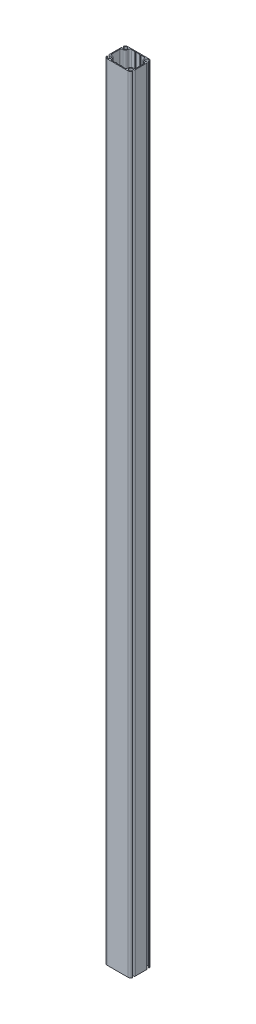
SolidWorks part; units mm, degrees
ref_plane "Alzado" through (0, 0, 0) normal (0, 0, 1) x (1, 0, 0)
ref_plane "Planta" through (0, 0, 0) normal (0, 1, 0) x (1, 0, 0)
ref_plane "Vista lateral" through (0, 0, 0) normal (1, 0, 0) x (0, 0, -1)
sketch "Croquis2" plane through (0, 0, 0) normal (0, 1, 0) x (1, 0, 0)
  line L0 (23.3364, 30.5) -> (62.311, 30.5) construction
  line L1 (40.5, 40) -> (-40.5, 40)
  line L2 (50, 21.5557) -> (50, -21.5557)
  line L5 (0, -51.871) -> (0, 72.2531) construction
  line L6 (-11, 35.5) -> (-8, 35.5)
  line L11 (-8, 35.5) -> (-6.5, 37)
  line L12 (-11, 35.5) -> (-12.5, 37)
  line L13 (40.5, 16.2383) -> (40.5, 49.0687) construction
  line L14 (24.5, 37) -> (12.5, 37)
  line L15 (47, 14.5) -> (47, -14.5)
  line L16 (11, 35.5) -> (12.5, 37)
  line L17 (8, 35.5) -> (6.5, 37)
  line L19 (11, 35.5) -> (8, 35.5)
  line L20 (-59.3231, 0) -> (58.6433, 0) construction
  line L21 (40.5, -16.2383) -> (40.5, -49.0687) construction
  line L22 (23.3364, -30.5) -> (62.311, -30.5) construction
  line L23 (24.5, -37) -> (12.5, -37)
  line L24 (40.5, -40) -> (-40.5, -40)
  line L26 (-23.3364, -30.5) -> (-62.311, -30.5) construction
  line L27 (-40.5, -16.2383) -> (-40.5, -49.0687) construction
  line L28 (-12.5, 37) -> (-24.5, 37)
  line L29 (6.5, 37) -> (-6.5, 37)
  line L30 (-40.5, 16.2383) -> (-40.5, 49.0687) construction
  line L31 (-8, -35.5) -> (-6.5, -37)
  line L32 (-11, -35.5) -> (-8, -35.5)
  line L33 (-11, -35.5) -> (-12.5, -37)
  line L34 (11, -35.5) -> (12.5, -37)
  line L35 (-23.3364, 30.5) -> (-62.311, 30.5) construction
  line L36 (-47, 14.5) -> (-47, -14.5)
  line L37 (-50, 21.5557) -> (-50, -21.5557)
  line L38 (11, -35.5) -> (8, -35.5)
  line L39 (8, -35.5) -> (6.5, -37)
  line L40 (-12.5, -37) -> (-24.5, -37)
  line L41 (6.5, -37) -> (-6.5, -37)
  arc A0 (49.7425, 32.697) -> (40.5, 40) centre (40.5, 30.5) ccw
  arc A1 (46.8238, 32.0032) -> (43.9048, 24.9631) centre (40.5, 30.5) ccw
  arc A2 (31, 30.5) -> (24.5, 37) centre (24.5, 30.5) ccw
  arc A3 (47, 14.5) -> (40.5, 21) centre (40.5, 14.5) ccw
  arc A9 (46.8238, 32.0032) -> (49.7425, 32.697) centre (48.2831, 32.3501) ccw
  arc A10 (50, 21.5557) -> (43.9048, 24.9631) centre (46, 21.5557) ccw
  arc A11 (50, -21.5557) -> (43.9048, -24.9631) centre (46, -21.5557) cw
  arc A12 (46.8238, -32.0032) -> (49.7425, -32.697) centre (48.2831, -32.3501) cw
  arc A13 (47, -14.5) -> (40.5, -21) centre (40.5, -14.5) cw
  arc A14 (31, -30.5) -> (24.5, -37) centre (24.5, -30.5) cw
  arc A15 (46.8238, -32.0032) -> (43.9048, -24.9631) centre (40.5, -30.5) cw
  arc A16 (49.7425, -32.697) -> (40.5, -40) centre (40.5, -30.5) cw
  arc A17 (-49.7425, -32.697) -> (-40.5, -40) centre (-40.5, -30.5) ccw
  arc A18 (-46.8238, -32.0032) -> (-43.9048, -24.9631) centre (-40.5, -30.5) ccw
  arc A19 (-31, -30.5) -> (-24.5, -37) centre (-24.5, -30.5) ccw
  arc A20 (-47, -14.5) -> (-40.5, -21) centre (-40.5, -14.5) ccw
  arc A21 (-46.8238, -32.0032) -> (-49.7425, -32.697) centre (-48.2831, -32.3501) ccw
  arc A22 (-50, -21.5557) -> (-43.9048, -24.9631) centre (-46, -21.5557) ccw
  arc A23 (-50, 21.5557) -> (-43.9048, 24.9631) centre (-46, 21.5557) cw
  arc A24 (-46.8238, 32.0032) -> (-49.7425, 32.697) centre (-48.2831, 32.3501) cw
  arc A25 (-47, 14.5) -> (-40.5, 21) centre (-40.5, 14.5) cw
  arc A26 (-31, 30.5) -> (-24.5, 37) centre (-24.5, 30.5) cw
  arc A27 (-46.8238, 32.0032) -> (-43.9048, 24.9631) centre (-40.5, 30.5) cw
  arc A28 (-49.7425, 32.697) -> (-40.5, 40) centre (-40.5, 30.5) cw
  arc A29 (31, 30.5) -> (40.5, 21) centre (40.5, 30.5) ccw
  arc A30 (-31, 30.5) -> (-40.5, 21) centre (-40.5, 30.5) cw
  arc A31 (31, -30.5) -> (40.5, -21) centre (40.5, -30.5) cw
  arc A32 (-31, -30.5) -> (-40.5, -21) centre (-40.5, -30.5) ccw
  point P29 (50, 0)
  point P53 (47, 0)
  point P54 (0, 37)
  point P55 (0, -37)
  point P56 (-47, 0)
  point P92 (0, -40)
  point P93 (0, 40)
  point P94 (-50, 0)
  dimension "D5" = 6.5
  dimension "D6" = 6.5
  dimension "D7" = 9.5
  dimension "D8" = 94
  dimension "D9" = 4
  dimension "D10" = 1.8501
  dimension "D2" = 80
  dimension "D3" = 100
  dimension "D4" = 74
  dimension "D11" = 1.5
  dimension "D12" = 45
  dimension "D13" = 3
  dimension "D14" = 45
  dimension "D15" = 8
extrude "Saliente-Extruir2" add sketch "Croquis2" along normal blind 3000
